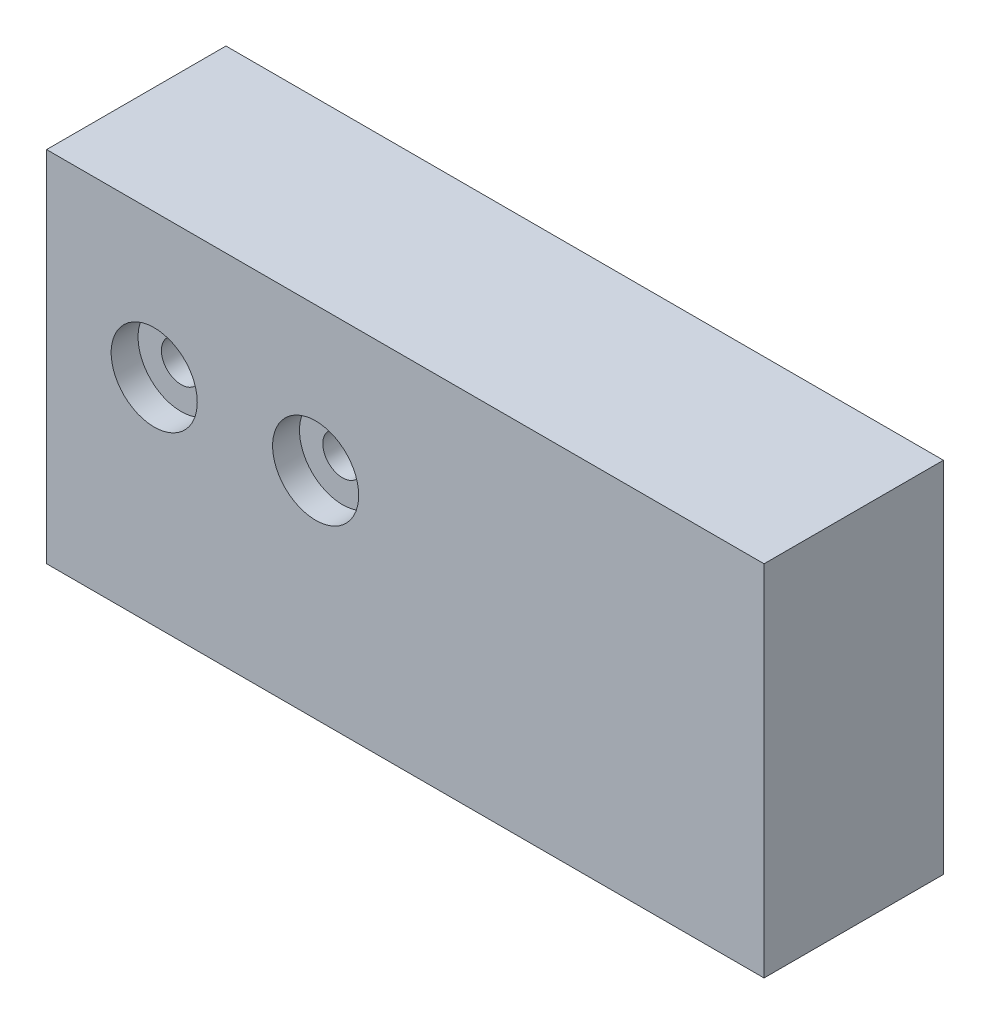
SolidWorks part; units mm, degrees
ref_plane "Płaszczyzna przednia" through (0, 0, 0) normal (0, 0, 1) x (1, 0, 0)
ref_plane "Płaszczyzna górna" through (0, 0, 0) normal (0, 1, 0) x (1, 0, 0)
ref_plane "Płaszczyzna prawa" through (0, 0, 0) normal (1, 0, 0) x (0, 0, -1)
sketch "Szkic1" plane through (0, 0, 0) normal (0, 0, 1) x (1, 0, 0)
  line L1 (100, -50) -> (-100, -50)
  line L2 (100, -50) -> (100, 50)
  line L3 (100, 50) -> (-100, 50)
  line L4 (-100, -50) -> (-100, 50)
  line L5 (100, -50) -> (-100, 50) construction
  line L6 (100, 50) -> (-100, -50) construction
  point P0 (0, 0)
  dimension "D1" = 100
  dimension "D2" = 200
extrude "Dodanie-wyciągnięcie1" add sketch "Szkic1" along normal blind 50
hole_wizard "Pogłębienie walcowe pod M10 Śrubę z łbem stożkowym ściętym1" positions "Szkic2" profile "Szkic3" counterbore size "M10" standard "ISO"
sketch "Szkic2" plane through (0, 0, 50) normal (0, 0, 1) x (1, 0, 0)
  line L0 (-100, 50) -> (-100, -50) construction
  line L1 (100, 50) -> (-100, 50) construction
  point P0 (-70, 10)
  point P2 (-25, 10)
  point P9 (0, 0)
  dimension "D1" = 30
  dimension "D2" = 40
  dimension "D3" = 45
sketch "Szkic3" plane through (-70, 10, 50) normal (1, 0, 0) x (0, -1, 0)
  line L0 (0, 0) -> (0, 50)
  line L1 (0, 50) -> (5.5, 50)
  line L3 (5.5, 50) -> (5.5, 7.5)
  line L4 (5.5, 7.5) -> (12, 7.5)
  line L5 (12, 7.5) -> (12, 0)
  line L7 (12, 0) -> (0, 0)
  line L11 (0, -6.35) -> (0, 107.95) construction
  dimension "Średnica otworu na wylot" = 11
  dimension "Głębokość otworu na wylot" = 50
  dimension "Średnica pogłębienia walcowego" = 24
  dimension "Głębokość pogłębienia walcowego" = 7.5
